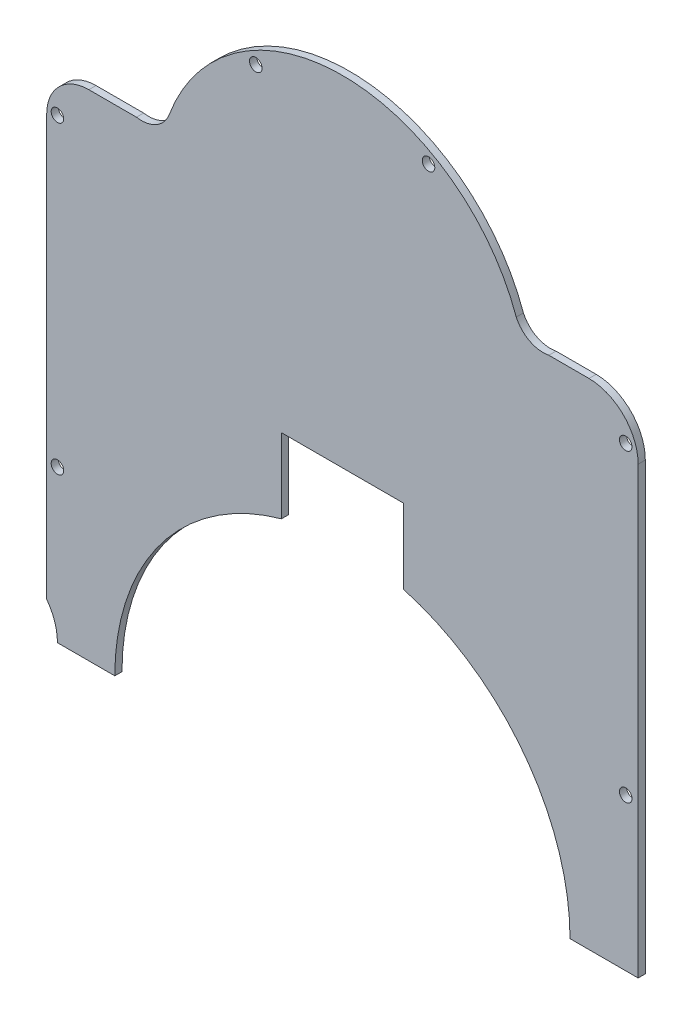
SolidWorks part; units mm, degrees
ref_plane "Plan de face" through (0, 0, 0) normal (0, 0, 1) x (1, 0, 0)
ref_plane "Plan de dessus" through (0, 0, 0) normal (0, 1, 0) x (1, 0, 0)
ref_plane "Plan de droite" through (0, 0, 0) normal (1, 0, 0) x (0, 0, -1)
sketch "Esquisse1" plane through (0, 0, 0) normal (0, 0, 1) x (1, 0, 0)
  line L0 (68.7872, 49.7857) -> (57.5809, 49.7857)
  line L1 (82.5, -88.2143) -> (82.5, 35.9208)
  line L2 (-82.5, 38.0313) -> (-82.5, -79.2143)
  line L3 (-57.4466, 49.7857) -> (-70.7455, 49.7857)
  line L4 (-82.5, -88.2143) -> (82.5, -88.2143) construction
  line L5 (-79.5, -88.2143) -> (-63.5, -88.2143)
  line L6 (82.5, -88.2143) -> (63.5, -88.2143)
  line L7 (0, 37.1228) -> (0, -109.5308) construction
  line L8 (-17, -27.0322) -> (-17, -6.2143)
  line L9 (-17, -6.2143) -> (17, -6.2143)
  line L10 (17, -6.2143) -> (17, -27.0322)
  line L11 (-45.4568, -88.2143) -> (-136.0349, -88.2143) construction
  line L12 (-82.5, -79.2143) -> (-82.5, -89.7613) construction
  arc A0 (48.4962, 54.477) -> (57.5809, 49.7857) centre (56.0069, 57.8797) ccw
  arc A1 (82.5, 35.9208) -> (68.7872, 49.7857) centre (68.6342, 35.9208) ccw
  arc A2 (-70.7455, 49.7857) -> (-82.5, 38.0313) centre (-70.7455, 38.0313) ccw
  arc A3 (-57.4466, 49.7857) -> (-48.3027, 55.0083) centre (-56.0219, 57.9073) ccw
  arc A4 (48.4962, 54.477) -> (-48.3027, 55.0083) centre (0, 37.1228) ccw
  arc A5 (-63.5, -88.2143) -> (-17, -27.0322) centre (0, -88.2143) cw
  arc A6 (17, -27.0322) -> (63.5, -88.2143) centre (0, -88.2143) cw
  arc A7 (-79.5, -88.2143) -> (-82.5, -79.2143) centre (-94.5, -88.2143) ccw
  point P28 (-79.5, -88.2143)
  dimension "D4" = 63.5
  dimension "D8" = 19
  dimension "D2" = 30
  dimension "D7" = 162
  dimension "D1" = 138
  dimension "D3" = 82
  dimension "D5" = 34
  dimension "D6" = 17
  dimension "D9" = 19
extrude "Extrusion1" add sketch "Esquisse1" along normal blind 2
hole_wizard "Trou taraudé M3.51" positions "Esquisse3D2" profile "Esquisse3" tap size "M3.5" standard "ISO"
sketch3d "Esquisse3D2"
  line L0 (-79.5, -88.2143, 2) -> (-79.5, 55.4631, 2) construction
  line L2 (-82.5, -88.2143, 0) -> (82.5, -88.2143, 0) construction
  line L3 (0, 37.1228, 0) -> (0, 96.2427, 0) construction
  line L5 (-24.1674, 79.125, 2) -> (0, 37.1228, 0) construction
  circle A0 centre (0, 37.1228, 0) radius 48.5
  point P0 (-24.1674, 79.125, 2)
  point P2 (-79.5, 39.2387, 2)
  point P4 (-79.5, -45.7613, 2)
  point P16 (0, 37.1228, 48.5)
  dimension "D3" = 97
  dimension "D1" = 42.5
  dimension "D2" = 85
  dimension "D4" = 30
  dimension "D5" = 48.5
sketch "Esquisse3" plane through (-24.1674, 79.125, 2) normal (1, 0, 0) x (0, -1, 0)
  line L0 (0, 0) -> (0, 2)
  line L1 (0, 2) -> (1.75, 2)
  line L2 (1.75, 2) -> (1.75, 0)
  line L5 (1.75, 0) -> (0, 0)
  line L11 (0, -6.35) -> (0, 107.95) construction
  dimension "Diamètre principal du filetage" = 3.5
  dimension "Profondeur du trou pour taraudage jusqu'au prochain" = 2
hole_wizard "Trou taraudé M3.52" positions "Esquisse3D3" profile "Esquisse6" tap size "M3.5" standard "ISO"
sketch3d "Esquisse3D3"
  line L0 (79.0359, 39.2387, 2) -> (79.0359, -93.2434, 2) construction
  line L3 (82.5, -88.2143, 0) -> (82.5, 35.9208, 0) construction
  line L4 (82.5, -88.2143, 0) -> (63.5, -88.2143, 0) construction
  line L5 (24.25, 79.125, 0) -> (0, 37.1228, 0) construction
  line L7 (0, 37.1228, 0) -> (0, 96.2427, 0) construction
  circle A1 centre (0, 37.1228, 0) radius 48.5 construction
  point P5 (79.0359, 39.2387, 2)
  point P7 (79.0359, -45.7613, 2)
  point P9 (112.0752, 0.075, 0)
  point P29 (24.0193, 79.2099, 2)
  point P37 (0, 37.1228, 48.5)
  dimension "D1" = 4
  dimension "D2" = 85
  dimension "D3" = 42.5
  dimension "D4" = 48.5
  dimension "D5" = 30
sketch "Esquisse6" plane through (79.0359, 39.2387, 2) normal (1, 0, 0) x (0, -1, 0)
  line L0 (0, 0) -> (0, 2)
  line L1 (0, 2) -> (1.75, 2)
  line L2 (1.75, 2) -> (1.75, 0)
  line L5 (1.75, 0) -> (0, 0)
  line L11 (0, -6.35) -> (0, 107.95) construction
  dimension "Diamètre principal du filetage" = 3.5
  dimension "Profondeur du trou pour taraudage jusqu'au prochain" = 2
